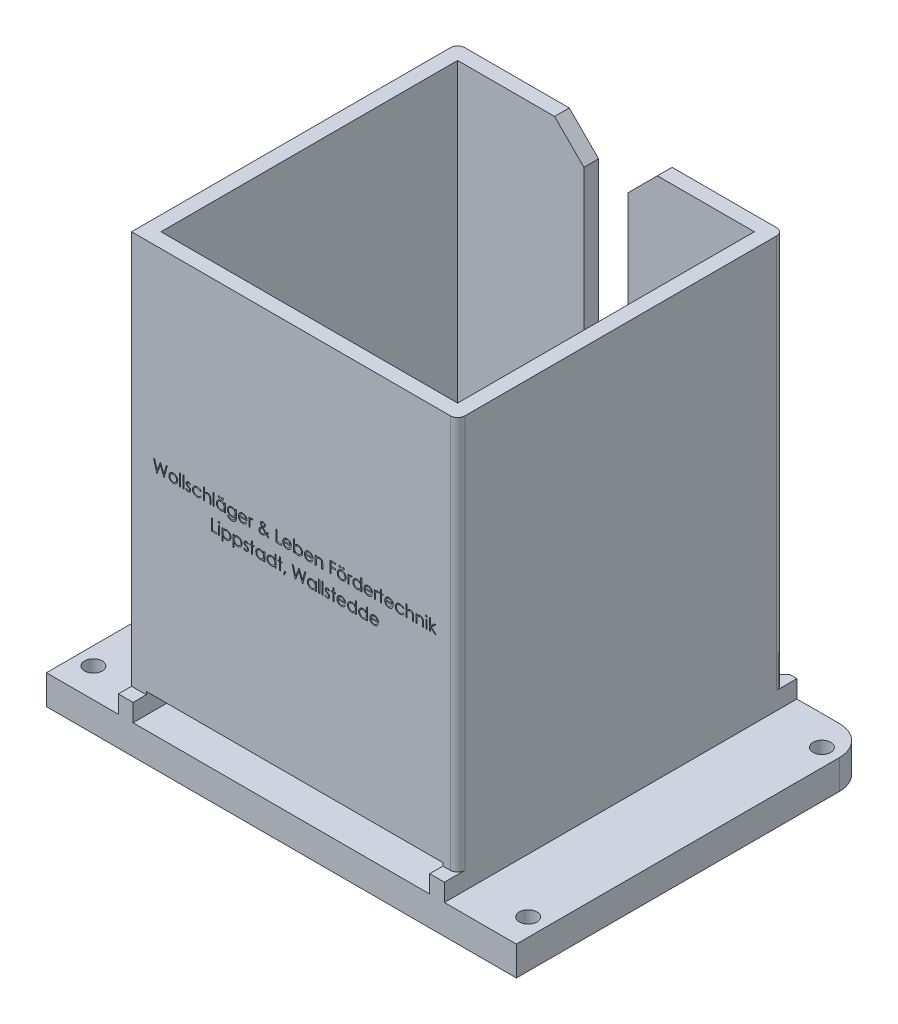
SolidWorks part; units mm, degrees
ref_plane "Ebene vorne" through (0, 0, 0) normal (0, 0, 1) x (1, 0, 0)
ref_plane "Ebene oben" through (0, 0, 0) normal (0, 1, 0) x (1, 0, 0)
ref_plane "Ebene rechts" through (0, 0, 0) normal (1, 0, 0) x (0, 0, -1)
sketch "Skizze1" plane through (0, 0, 0) normal (0, 1, 0) x (1, 0, 0)
  line L0 (0, 60) -> (0, -60) construction
  line L1 (-80, -60) -> (80, -60)
  line L2 (-80, -60) -> (-80, 60)
  line L3 (-80, 60) -> (80, 60)
  line L4 (80, -60) -> (80, 60)
  line L5 (-80, -60) -> (80, 60) construction
  line L6 (-80, 60) -> (80, -60) construction
  line L7 (-80, 0) -> (80, 0) construction
  circle A0 centre (-74, 50) radius 3
  circle A1 centre (-74, -50) radius 3
  circle A2 centre (74, -50) radius 3
  circle A3 centre (74, 50) radius 3
  point P0 (0, 0)
  dimension "D3" = 6
  dimension "D1" = 120
  dimension "D2" = 160
  dimension "D4" = 6
  dimension "D5" = 100
extrude "Aufsatz-Linear austragen1" add sketch "Skizze1" along normal blind 10
sketch "Skizze2" plane through (0, 10, 0) normal (0, 1, 0) x (1, 0, 0)
  line L0 (-55.5, 55.5) -> (55.5, 55.5)
  line L1 (-50.5, -50.5) -> (50.5, -50.5)
  line L2 (-50.5, -50.5) -> (-50.5, 50.5)
  line L3 (-50.5, 50.5) -> (50.5, 50.5)
  line L4 (50.5, -50.5) -> (50.5, 50.5)
  line L5 (-50.5, -50.5) -> (50.5, 50.5) construction
  line L6 (-50.5, 50.5) -> (50.5, -50.5) construction
  line L7 (55.5, -55.5) -> (55.5, 55.5)
  line L8 (-55.5, -55.5) -> (55.5, -55.5)
  line L9 (-55.5, -55.5) -> (-55.5, 55.5)
  point P0 (0, 0)
  dimension "D1" = 101
  dimension "D2" = 101
  dimension "D3" = 5
extrude "Aufsatz-Linear austragen2" add sketch "Skizze2" along normal blind 140 contours L0 L7 L8 L9 | L2 L1 L4 L3
sketch "Skizze4" plane through (0, 10, 0) normal (0, 1, 0) x (1, 0, 0)
  line L0 (-80, -60) -> (80, -60) construction
  line L1 (-55.5, -55.5) -> (-50.5, -55.5)
  line L2 (-55.5, -55.5) -> (-55.5, -60)
  line L3 (-55.5, -60) -> (-50.5, -60)
  line L4 (-50.5, -55.5) -> (-50.5, -60)
  line L5 (-50.5, -50.5) -> (-50.5, 50.5) construction
  line L6 (0, 0) -> (0, -60) construction
  line L7 (0, 0) -> (-55.5, 0) construction
  line L8 (-55.5, -55.5) -> (-55.5, 55.5) construction
  line L9 (55.5, -60) -> (50.5, -60)
  line L10 (50.5, -55.5) -> (50.5, -60)
  line L11 (55.5, -55.5) -> (50.5, -55.5)
  line L12 (55.5, -55.5) -> (55.5, -60)
  line L13 (55.5, 55.5) -> (55.5, 60)
  line L14 (55.5, 55.5) -> (50.5, 55.5)
  line L15 (50.5, 55.5) -> (50.5, 60)
  line L16 (55.5, 60) -> (50.5, 60)
  line L17 (-55.5, 60) -> (-50.5, 60)
  line L18 (-50.5, 55.5) -> (-50.5, 60)
  line L19 (-55.5, 55.5) -> (-50.5, 55.5)
  line L20 (-55.5, 55.5) -> (-55.5, 60)
extrude "Aufsatz-Linear austragen3" add sketch "Skizze4" along normal blind 6 contours L17 L18 L19 L20 | L13 L16 L15 L14 | L9 L10 L11 L12 | L2 L1 L4 L3
sketch "Skizze5" plane through (0, 0, 55.5) normal (0, 0, 1) x (1, 0, 0)
  line L0 (50.5, 16) -> (50.5, 10) construction
  line L1 (-50.5, 10) -> (50.5, 10)
  line L2 (-50.5, 10) -> (-50.5, 17)
  line L3 (-50.5, 17) -> (50.5, 17)
  line L4 (50.5, 10) -> (50.5, 17)
  dimension "D1" = 7
extrude "Schnitt-Linear austragen1" cut sketch "Skizze5" against normal up to next
sketch "Skizze6" plane through (0, 0, -55.5) normal (0, 0, -1) x (-1, 0, 0)
  line L1 (50.5, 10) -> (-50.5, 10)
  line L2 (50.5, 10) -> (50.5, 16)
  line L3 (50.5, 16) -> (-50.5, 16)
  line L4 (-50.5, 10) -> (-50.5, 16)
extrude "Schnitt-Linear austragen2" cut sketch "Skizze6" against normal up to next
sketch "Skizze7" plane through (0, 0, -55.5) normal (0, 0, -1) x (-1, 0, 0)
  line L0 (0, 150) -> (0, 36) construction
  line L1 (55.5, 150) -> (-55.5, 150) construction
  line L2 (7.5, 150) -> (7.5, 36)
  line L3 (-7.5, 150) -> (-7.5, 36)
  line L4 (50.5, 16) -> (-50.5, 16) construction
  arc A0 (7.5, 150) -> (-7.5, 150) centre (0, 150) ccw
  arc A1 (-7.5, 36) -> (7.5, 36) centre (0, 36) ccw
  point P5 (0, 93)
  dimension "D1" = 15
  dimension "D2" = 20
extrude "Schnitt-Linear austragen3" cut sketch "Skizze7" against normal up to next
chamfer "Fase1" distance 10 angle 45 2 edges at (7.5, 150, -53) (-7.5, 150, -53)
sketch "Skizze8" plane through (0, 0, 55.5) normal (0, 0, 1) x (1, 0, 0)
  line L0 (-55.5, 83) -> (55.5, 83) construction
  line L1 (-55.5, 150) -> (-55.5, 16) construction
  line L2 (55.5, 150) -> (55.5, 16) construction
  text T0 "Wollschläger & Leben Fördertechnik  Lippstadt, Wallstedde" font "Century Gothic" height 4
extrude "Schnitt-Linear austragen4" cut sketch "Skizze8" against normal blind 1
fillet "Verrundung1" radius 10 2 edges at (-80, 5, -60) (80, 5, -60)
fillet "Verrundung2" radius 2.5 3 edges at (55.5, 83, -55.5) (55.5, 83, 55.5) (-55.5, 83, -55.5)
chamfer "Fase2" distance 2.5 angle 45 2 edges at (50.5, 13, -60) (-50.5, 13, -60)
sketch "Skizze9" plane through (0, 0, 0) normal (0, -1, 0) x (1, 0, 0)
  circle A0 centre (0, 0) radius 10
  dimension "D1" = 20
extrude "Schnitt-Linear austragen5" cut sketch "Skizze9" against normal up to next
chamfer "Fase3" distance 1 angle 45 1 edges at (0, 10, -10)
equation "\"Lochgröße\"= 6mm"
equation "\"Lochabstande_Rand\"= 6mm"
